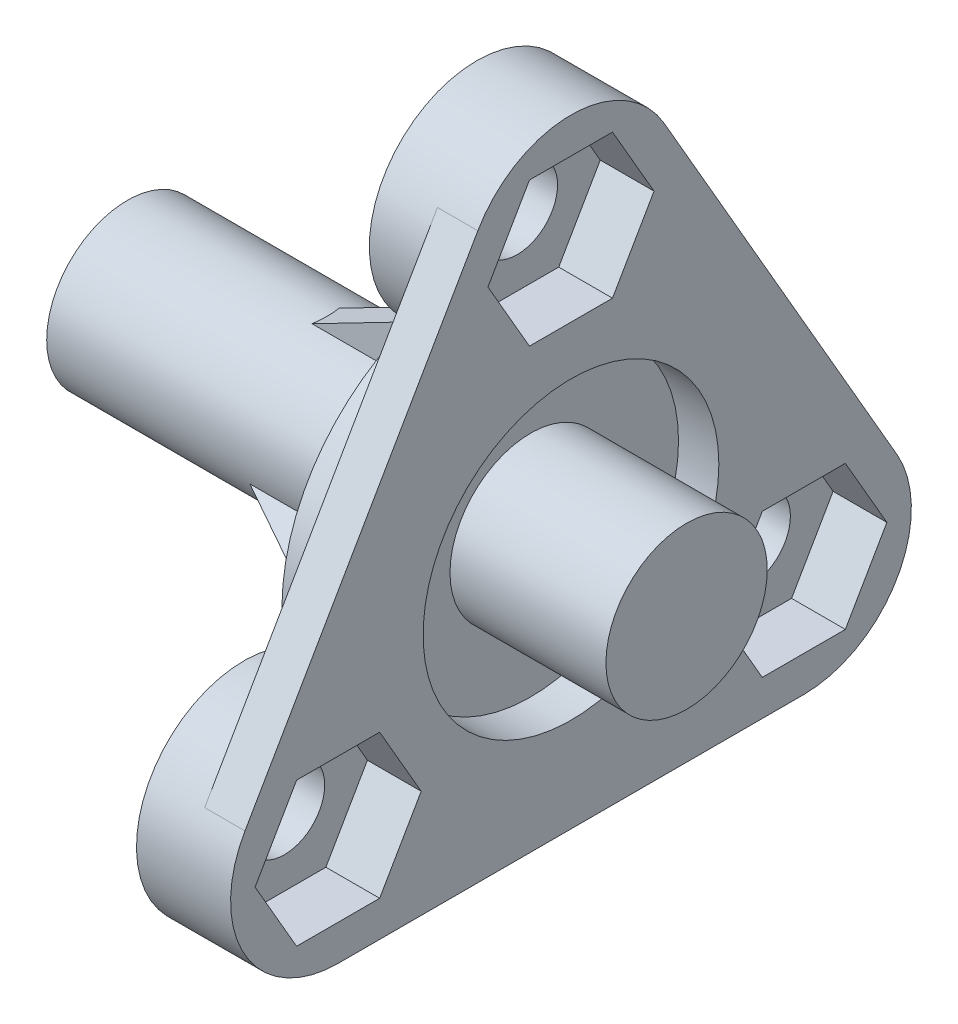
SolidWorks part; units mm, degrees
ref_plane "Plan de face" through (0, 0, 0) normal (0, 0, 1) x (1, 0, 0)
ref_plane "Plan de dessus" through (0, 0, 0) normal (0, 1, 0) x (1, 0, 0)
ref_plane "Plan de droite" through (0, 0, 0) normal (1, 0, 0) x (0, 0, -1)
sketch "Esquisse1" plane through (0, 0, 0) normal (1, 0, 0) x (0, 0, -1)
  line L0 (0, 12.6826) -> (0, -10.6501) construction
  line L1 (15.2578, 0) -> (-4.7156, 0) construction
  line L2 (-3.4641, 12) -> (-12.1244, -3)
  line L3 (8.6603, -9) -> (-8.6603, -9)
  line L4 (12.1244, -3) -> (3.4641, 12)
  circle A0 centre (0, 10) radius 1.5
  arc A1 (3.4641, 12) -> (-3.4641, 12) centre (0, 10) ccw
  circle A2 centre (8.6603, -5) radius 1.5
  arc A3 (8.6603, -9) -> (12.1244, -3) centre (8.6603, -5) ccw
  circle A4 centre (-8.6603, -5) radius 1.5
  arc A5 (-12.1244, -3) -> (-8.6603, -9) centre (-8.6603, -5) ccw
  circle A6 centre (0, 0) radius 5.5
  point P18 (0, 0)
  point P19 (0, 0)
  point P21 (0.0412, 0.116)
  point P25 (-0.3422, -0.5959)
  point P29 (-0.041, 0.1186)
  point P30 (0, 0)
extrude "Boss.-Extru.1" add sketch "Esquisse1" along normal blind 1.5
sketch "Esquisse7" plane through (0, 0, 0) normal (-1, 0, 0) x (0, 0, 1)
  arc A0 (7.1319, -1.3035) -> (2.437, 6.8281) centre (0, 0) ccw
  arc A1 (2.437, 6.8281) -> (-2.437, 6.8281) centre (0, 10) ccw
  arc A2 (4.6948, -5.5246) -> (7.1319, -1.3035) centre (8.6603, -5) ccw
  arc A3 (-7.1319, -1.3035) -> (-4.6948, -5.5246) centre (-8.6603, -5) ccw
  circle A4 centre (0, 0) radius 1.5
  arc A5 (-2.437, 6.8281) -> (-7.1319, -1.3035) centre (0, 0) ccw
  arc A6 (-4.6948, -5.5246) -> (4.6948, -5.5246) centre (0, 0) ccw
  circle A7 centre (0, 10) radius 1.5
  circle A8 centre (8.6603, -5) radius 1.5
  circle A9 centre (-8.6603, -5) radius 1.5
extrude "Boss.-Extru.2" add sketch "Esquisse7" along normal blind 2
sketch "Esquisse9" plane through (-2, 0, 0) normal (-1, 0, 0) x (0, 0, 1)
  circle A0 centre (0, 0) radius 1.5
  circle A1 centre (0, 0) radius 3
extrude "Boss.-Extru.3" add sketch "Esquisse9" along normal blind 13
sketch "Esquisse10" plane through (1.5, 0, 0) normal (1, 0, 0) x (0, 0, -1)
  line L1 (3.0888, 10) -> (1.5444, 12.675)
  line L2 (1.5444, 12.675) -> (-1.5444, 12.675)
  line L3 (-1.5444, 12.675) -> (-3.0888, 10)
  line L4 (-3.0888, 10) -> (-1.5444, 7.325)
  line L5 (-1.5444, 7.325) -> (1.5444, 7.325)
  line L6 (1.5444, 7.325) -> (3.0888, 10)
  line L7 (11.7491, -5) -> (10.2047, -2.325)
  line L8 (10.2047, -2.325) -> (7.1158, -2.325)
  line L9 (7.1158, -2.325) -> (5.5714, -5)
  line L10 (5.5714, -5) -> (7.1158, -7.675)
  line L11 (7.1158, -7.675) -> (10.2047, -7.675)
  line L12 (10.2047, -7.675) -> (11.7491, -5)
  line L13 (-5.5714, -5) -> (-7.1158, -2.325)
  line L14 (-7.1158, -2.325) -> (-10.2047, -2.325)
  line L15 (-10.2047, -2.325) -> (-11.7491, -5)
  line L16 (-11.7491, -5) -> (-10.2047, -7.675)
  line L17 (-10.2047, -7.675) -> (-7.1158, -7.675)
  line L18 (-7.1158, -7.675) -> (-5.5714, -5)
  circle A0 centre (0, 10) radius 2.675 construction
  circle A1 centre (8.6603, -5) radius 2.675 construction
  circle A2 centre (-8.6603, -5) radius 2.675 construction
extrude "Enlèv. mat.-Extru.1" cut sketch "Esquisse10" against normal blind 2
sketch "Esquisse11" plane through (0, 0, 0) normal (1, 0, 0) x (0, 0, -1)
  circle A0 centre (0, 0) radius 3
extrude "Boss.-Extru.4" add sketch "Esquisse11" along normal blind 5.8
ref_plane "Plan1" through (0, 0, 0) normal (0, 0, 1) x (1, 0, 0)
sketch "Esquisse12" plane through (0, 0, 0) normal (0, 0, 1) x (1, 0, 0)
  line L0 (-2, 16.7314) -> (-2, -0.2394) construction
  line L1 (-2, 6.8281) -> (-2, -1.3035) construction
  line L2 (-8, 16.7314) -> (-8, 1.8652) construction
  line L3 (-17.0609, 2.7672) -> (-0.7916, 2.7672) construction
  line L4 (-17.0609, 5.8672) -> (-0.7916, 5.8672) construction
  line L5 (-8, 2.7672) -> (-2, 5.8672)
  line L6 (-2, 5.8672) -> (-2, 2.7672)
  line L7 (-2, 2.7672) -> (-8, 2.7672)
  dimension "D1" = 6
  dimension "D2" = 3.1
extrude "Boss.-Extru.5" add sketch "Esquisse12" along normal mid plane 1
pattern_circular "Répétition circulaire1" count 3 over 360 about axis through (0, 0, 0) along (1, 0, 0) of "Boss.-Extru.5"
